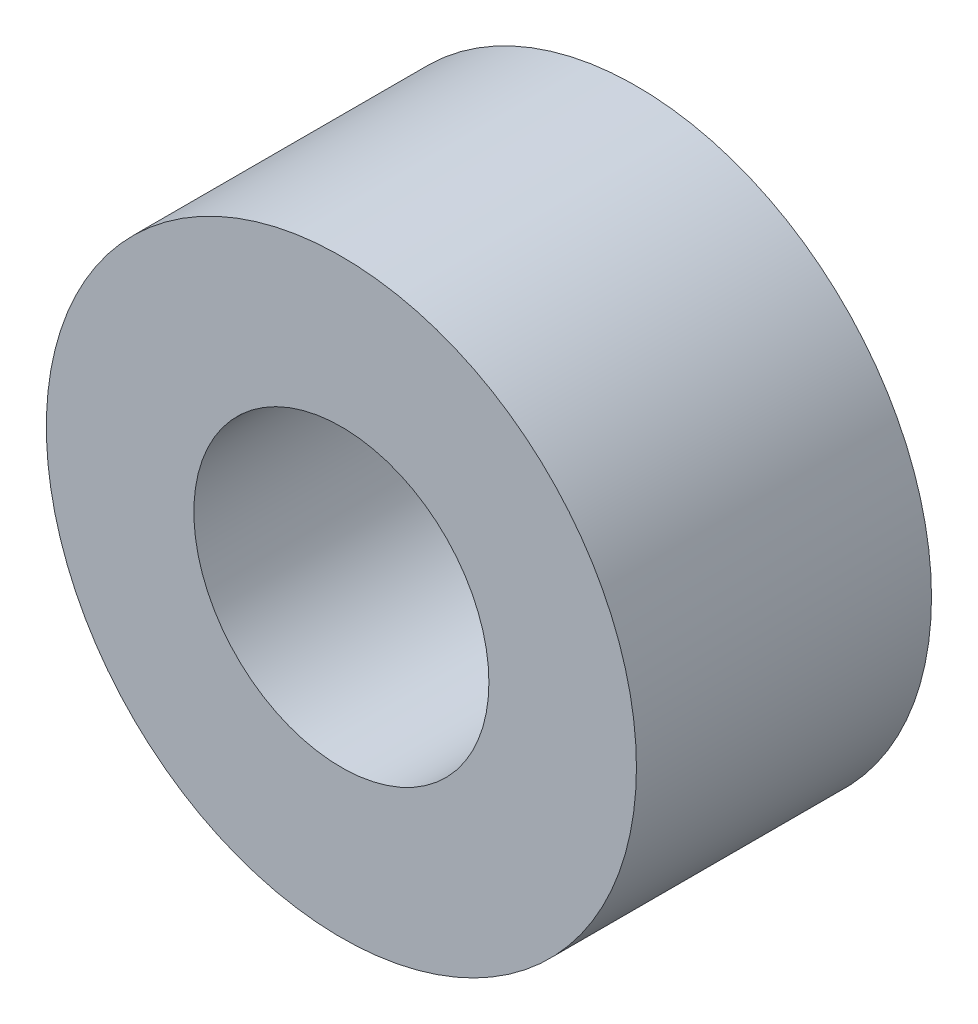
SolidWorks part; units mm, degrees
ref_plane "Front" through (0, 0, 0) normal (0, 0, 1) x (1, 0, 0)
ref_plane "Top" through (0, 0, 0) normal (0, 1, 0) x (1, 0, 0)
ref_plane "Right" through (0, 0, 0) normal (1, 0, 0) x (0, 0, -1)
sketch "Esquisse1" plane through (0, 0, 0) normal (0, 0, 1) x (1, 0, 0)
  circle A0 centre (0, 0) radius 3
  circle A1 centre (0, 0) radius 1.5
  dimension "D1" = 3
  dimension "D2" = 6
extrude "Boss.-Extru.1" add sketch "Esquisse1" along normal blind 3
